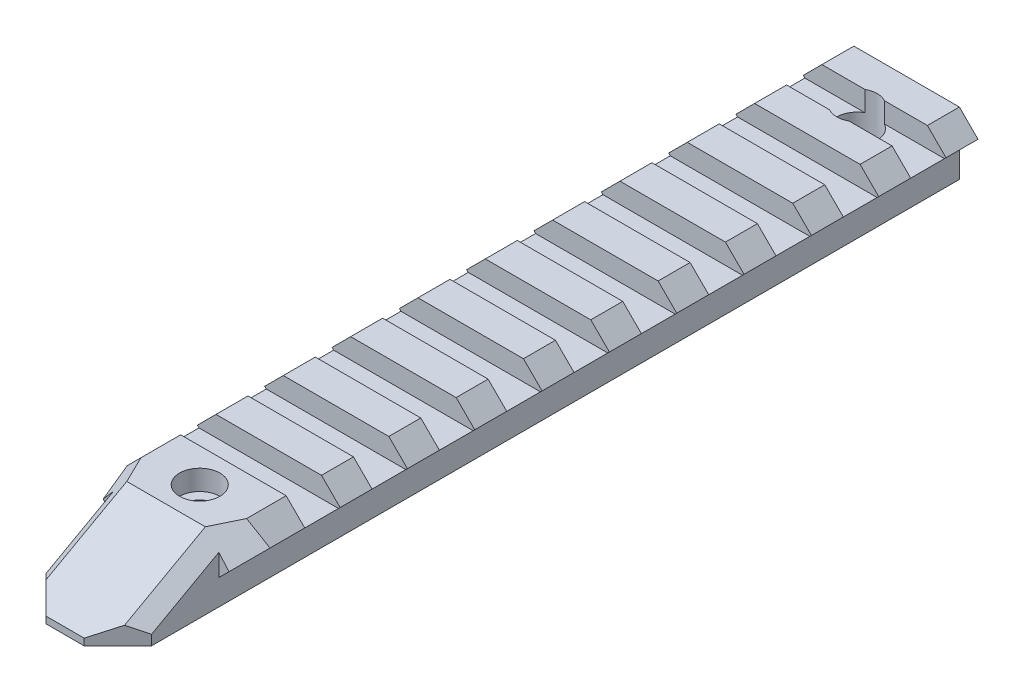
SolidWorks part; units mm, degrees
ref_plane "前视基准面" through (0, 0, 0) normal (0, 0, 1) x (1, 0, 0)
ref_plane "上视基准面" through (0, 0, 0) normal (0, 1, 0) x (1, 0, 0)
ref_plane "右视基准面" through (0, 0, 0) normal (1, 0, 0) x (0, 0, -1)
other "Configuration Table"
sketch "草图2" plane through (0, 0, 0) normal (0, 0, 1) x (1, 0, 0)
  line L0 (-26.0262, 29.9696) -> (-28.7912, 27.2046)
  line L1 (-28.7912, 29.9696) -> (-7.5912, 29.9696)
  line L2 (-28.7912, 29.9696) -> (-28.7912, 20.6496)
  line L3 (-28.7912, 20.6496) -> (-7.5912, 20.6496)
  line L4 (-7.5912, 29.9696) -> (-7.5912, 20.6496)
  line L5 (-28.7912, 29.9696) -> (-7.5912, 20.6496) construction
  line L6 (-28.7912, 20.6496) -> (-7.5912, 29.9696) construction
  line L7 (-26.0262, 20.6496) -> (-10.3562, 20.6496)
  line L8 (-26.0262, 20.6496) -> (-26.0262, 29.9696)
  line L9 (-26.0262, 29.9696) -> (-10.3562, 29.9696)
  line L10 (-10.3562, 20.6496) -> (-10.3562, 29.9696)
  line L11 (-26.0262, 20.6496) -> (-10.3562, 29.9696) construction
  line L12 (-26.0262, 29.9696) -> (-10.3562, 20.6496) construction
  line L13 (-28.7912, 27.2046) -> (-26.0262, 24.4396)
  line L14 (-18.1912, 29.9696) -> (-18.1912, 20.6496) construction
  line L15 (-7.5912, 27.2046) -> (-10.3562, 24.4396)
  line L16 (-10.3562, 29.9696) -> (-7.5912, 27.2046)
  point P0 (-18.1912, 25.3096)
  point P5 (-18.1912, 25.3096)
  dimension "D1" = 9.32
  dimension "D2" = 21.2
  dimension "D3" = 9.32
  dimension "D4" = 15.67
  dimension "D5" = 45
  dimension "D6" = 45
extrude "凸台-拉伸1" add sketch "草图2" along normal blind 110 contours L0 L13 L8 | L3 L10 L1 L8 | L16 L10 L15
sketch "草图3" plane through (0, 29.9696, 0) normal (0, 1, 0) x (1, 0, 0)
  line L1 (-28.7912, -4.75) -> (-7.5912, -4.75)
  line L2 (-28.7912, -4.75) -> (-28.7912, -10)
  line L3 (-28.7912, -10) -> (-7.5912, -10)
  line L4 (-7.5912, -4.75) -> (-7.5912, -10)
  line L6 (-28.7912, -14.75) -> (-28.7912, -20)
  line L7 (-26.0262, 0) -> (-10.3562, 0) construction
  line L8 (-28.7912, -14.75) -> (-7.5912, -14.75)
  line L9 (-7.5912, -14.75) -> (-7.5912, -20)
  line L10 (-28.7912, -20) -> (-7.5912, -20)
  line L11 (-28.7912, -24.75) -> (-28.7912, -30)
  line L12 (-28.7912, -24.75) -> (-7.5912, -24.75)
  line L13 (-7.5912, -24.75) -> (-7.5912, -30)
  line L14 (-28.7912, -30) -> (-7.5912, -30)
  line L15 (-28.7912, -34.75) -> (-28.7912, -40)
  line L16 (-28.7912, -34.75) -> (-7.5912, -34.75)
  line L17 (-7.5912, -34.75) -> (-7.5912, -40)
  line L18 (-28.7912, -40) -> (-7.5912, -40)
  line L19 (-28.7912, -44.75) -> (-28.7912, -50)
  line L20 (-28.7912, -44.75) -> (-7.5912, -44.75)
  line L21 (-7.5912, -44.75) -> (-7.5912, -50)
  line L22 (-28.7912, -50) -> (-7.5912, -50)
  line L23 (-28.7912, -54.75) -> (-28.7912, -60)
  line L24 (-28.7912, -54.75) -> (-7.5912, -54.75)
  line L25 (-7.5912, -54.75) -> (-7.5912, -60)
  line L26 (-28.7912, -60) -> (-7.5912, -60)
  line L27 (-28.7912, -64.75) -> (-28.7912, -70)
  line L28 (-28.7912, -64.75) -> (-7.5912, -64.75)
  line L29 (-7.5912, -64.75) -> (-7.5912, -70)
  line L30 (-28.7912, -70) -> (-7.5912, -70)
  line L31 (-28.7912, -74.75) -> (-28.7912, -80)
  line L32 (-28.7912, -74.75) -> (-7.5912, -74.75)
  line L33 (-7.5912, -74.75) -> (-7.5912, -80)
  line L34 (-28.7912, -80) -> (-7.5912, -80)
  line L35 (-28.7912, -84.75) -> (-28.7912, -90)
  line L36 (-28.7912, -84.75) -> (-7.5912, -84.75)
  line L37 (-7.5912, -84.75) -> (-7.5912, -90)
  line L38 (-28.7912, -90) -> (-7.5912, -90)
  line L39 (-28.7912, -94.75) -> (-28.7912, -100)
  line L40 (-28.7912, -94.75) -> (-7.5912, -94.75)
  line L41 (-7.5912, -94.75) -> (-7.5912, -100)
  line L42 (-28.7912, -100) -> (-7.5912, -100)
  line L43 (-18.1912, 0) -> (-18.1912, -22.7265) construction
  point P6 (-18.1912, -4.75)
  dimension "D1" = 5.25
  dimension "D2" = 10
  dimension "D4" = 21.2
  dimension "D3" = 10
extrude "切除-拉伸1" cut sketch "草图3" against normal blind 3
sketch "草图4" plane through (0, 29.9696, 0) normal (0, 1, 0) x (1, 0, 0)
  line L0 (-18.1912, -100) -> (-18.1912, -110) construction
  line L1 (-28.5562, -100) -> (-7.8262, -100) construction
  line L2 (-26.0262, -110) -> (-10.3562, -110) construction
  circle A0 centre (-18.1912, -105) radius 3
  dimension "D1" = 6
extrude "切除-拉伸2" cut sketch "草图4" against normal blind 3
sketch "草图5" plane through (0, 26.9696, 0) normal (0, 1, 0) x (1, 0, 0)
  circle A0 centre (-18.1912, -105) radius 1.5
  dimension "D1" = 3
extrude "切除-拉伸3" cut sketch "草图5" against normal through all
sketch "草图6" plane through (-10.3562, 0, 0) normal (1, 0, 0) x (0, 0, -1)
  line L0 (-110, 20.6496) -> (-125, 20.6496)
  line L1 (-125, 20.6496) -> (-125, 21.6496)
  line L2 (-125, 21.6496) -> (-110, 29.9696)
  line L3 (-110, 29.9696) -> (-110, 20.6496)
  dimension "D1" = 15
  dimension "D2" = 1
extrude "凸台-拉伸2" add sketch "草图6" against normal up to vertex
chamfer "倒角1" distance 5 angle 45 2 edges at (-10.3562, 21.1496, 125) (-26.0262, 21.1496, 125)
chamfer "倒角2" distance 2 angle 45 2 edges at (-10.3562, 27.1962, 115) (-26.0262, 27.1962, 115)
sketch "草图7" plane through (0, 26.9696, 0) normal (0, 1, 0) x (1, 0, 0)
  line L0 (-18.1912, -10) -> (-18.1912, -4.75) construction
  line L1 (-28.5562, -10) -> (-7.8262, -10) construction
  line L2 (-7.8262, -4.75) -> (-28.5562, -4.75) construction
  circle A0 centre (-18.1912, -7.375) radius 1.65
  dimension "D1" = 3.3
extrude "切除-拉伸4" cut sketch "草图7" against normal through all
sketch "草图8" plane through (0, 26.9696, 0) normal (0, 1, 0) x (1, 0, 0)
  circle A0 centre (-18.1912, -7.375) radius 3
  dimension "D1" = 6
extrude "切除-拉伸5" cut sketch "草图8" against normal blind 3 and the other way through all
